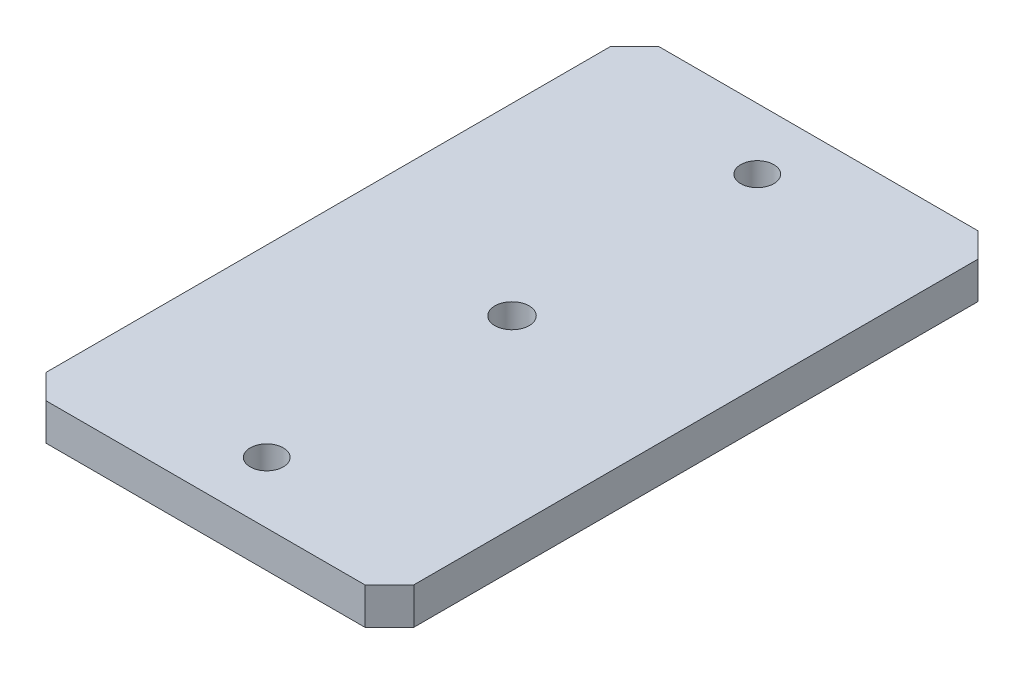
SolidWorks part; units mm, degrees
ref_plane "Plan de face" through (0, 0, 0) normal (0, 0, 1) x (1, 0, 0)
ref_plane "Plan de dessus" through (0, 0, 0) normal (0, 1, 0) x (1, 0, 0)
ref_plane "Plan de droite" through (0, 0, 0) normal (1, 0, 0) x (0, 0, -1)
sketch "Esquisse1" plane through (0, 0, 0) normal (0, 1, 0) x (1, 0, 0)
  line L0 (-75, -125) -> (-75, 125)
  line L1 (-75, 125) -> (75, 125)
  line L2 (75, 125) -> (75, -125)
  line L3 (75, -125) -> (-75, -125)
  line L5 (-75, -125) -> (75, 125)
  line L6 (75, -125) -> (-75, 125)
  dimension "D1" = 150
  dimension "D2" = 250
extrude "Extrusion1" add sketch "Esquisse1" along normal blind 15 contours L6 L2 L5 | L3 L6 L5 | L5 L6 L0 | L6 L5 L1
hole_wizard "Dégagement M121" positions "Esquisse3D1" profile "Esquisse2" hole size "M12" standard "ISO"
sketch3d "Esquisse3D1"
  line L0 (-75, 15, 0) -> (75, 15, 0) construction
  line L1 (-75, 15, 125) -> (-75, 15, -125) construction
  line L2 (75, 15, -125) -> (75, 15, 125) construction
  line L4 (0, 15, 125) -> (0, 15, -125) construction
  line L5 (75, 15, 125) -> (-75, 15, 125) construction
  line L6 (-75, 15, -125) -> (75, 15, -125) construction
  point P0 (0, 15, 100)
  point P19 (0, 15, -100)
  dimension "D1" = 100
  dimension "D2" = 100
sketch "Esquisse2" plane through (0, 15, 100) normal (1, 0, 0) x (0, 0, 1)
  line L0 (0, 0) -> (0, 15)
  line L1 (0, 15) -> (6.75, 15)
  line L2 (6.75, 15) -> (6.75, 0)
  line L5 (6.75, 0) -> (0, 0)
  line L11 (0, -6.35) -> (0, 107.95) construction
  dimension "Diamètre du perçage jusqu'au prochain" = 13.5
  dimension "Profondeur du perçage jusqu'au prochain" = 15
hole_wizard "Trou taraudé M161" positions "Esquisse3D2" profile "Esquisse3" tap size "M16" standard "ISO"
sketch3d "Esquisse3D2"
  line L0 (-75, 15, 0) -> (75, 15, 0) construction
  line L1 (-75, 15, 125) -> (-75, 15, -125) construction
  line L2 (75, 15, -125) -> (75, 15, 125) construction
  line L4 (0, 15, 125) -> (0, 15, -125) construction
  line L5 (75, 15, 125) -> (-75, 15, 125) construction
  line L6 (-75, 15, -125) -> (75, 15, -125) construction
  point P0 (0, 15, 0)
sketch "Esquisse3" plane through (0, 15, 0) normal (1, 0, 0) x (0, 0, 1)
  line L0 (0, 0) -> (0, 15)
  line L1 (0, 15) -> (7, 15)
  line L2 (7, 15) -> (7, 0)
  line L5 (7, 0) -> (0, 0)
  line L11 (0, -6.35) -> (0, 107.95) construction
  dimension "Diamètre du trou pour taraudage jusqu'au prochain" = 14
  dimension "Profondeur du trou pour taraudage jusqu'au prochain" = 15
chamfer "Chanfrein1" distance 10 angle 45 4 edges at (-75, 7.5, -125) (-75, 7.5, 125) (75, 7.5, 125) (75, 7.5, -125)
